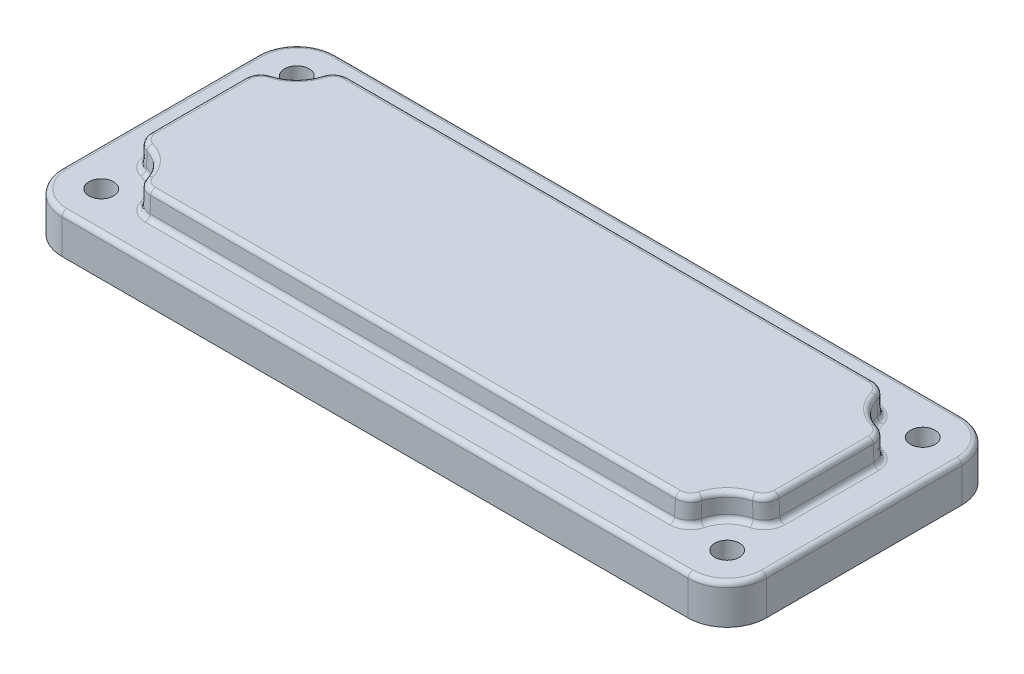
SolidWorks part; units mm, degrees
ref_plane "Front" through (0, 0, 0) normal (0, 0, 1) x (1, 0, 0)
ref_plane "Top" through (0, 0, 0) normal (0, 1, 0) x (1, 0, 0)
ref_plane "Right" through (0, 0, 0) normal (1, 0, 0) x (0, 0, -1)
sketch "Sketch1" plane through (0, 0, 0) normal (0, 1, 0) x (1, 0, 0)
  line L0 (-50.8, 22.225) -> (50.8, 22.225)
  line L1 (-57.15, 15.875) -> (-57.15, -15.875)
  line L2 (50.8, -22.225) -> (-50.8, -22.225)
  line L3 (57.15, -15.875) -> (57.15, 15.875)
  line L4 (-50.8, -15.875) -> (50.8, 15.875) construction
  arc A0 (-57.15, -15.875) -> (-50.8, -22.225) centre (-50.8, -15.875) ccw
  arc A1 (57.15, -15.875) -> (50.8, -22.225) centre (50.8, -15.875) cw
  arc A2 (50.8, 22.225) -> (57.15, 15.875) centre (50.8, 15.875) cw
  arc A3 (-50.8, 22.225) -> (-57.15, 15.875) centre (-50.8, 15.875) ccw
  dimension "D1" = 114.3
  dimension "D2" = 44.45
  dimension "D4" = 6.35
extrude "Base-Extrude" add sketch "Sketch1" along normal blind 6.35
sketch "Sketch2" plane through (0, 6.35, 0) normal (0, 1, 0) x (-1, 0, 0)
  line L4 (50.8, 16.225) -> (-50.8, 16.225)
  line L5 (-51.15, 15.875) -> (-51.15, -15.875)
  line L6 (-50.8, -16.225) -> (50.8, -16.225)
  line L7 (51.15, -15.875) -> (51.15, 15.875)
  line L8 (50.8, 16.225) -> (-50.8, 16.225)
  line L9 (-51.15, 15.875) -> (-51.15, -15.875)
  line L10 (-50.8, -16.225) -> (50.8, -16.225)
  line L11 (51.15, -15.875) -> (51.15, 15.875)
  arc A4 (51.15, 15.875) -> (50.8, 16.225) centre (50.8, 15.875) ccw
  arc A5 (51.15, 15.875) -> (50.8, 16.225) centre (50.8, 15.875) ccw
  arc A6 (-50.8, 16.225) -> (-51.15, 15.875) centre (-50.8, 15.875) ccw
  arc A7 (-50.8, 16.225) -> (-51.15, 15.875) centre (-50.8, 15.875) ccw
  arc A8 (-51.15, -15.875) -> (-50.8, -16.225) centre (-50.8, -15.875) ccw
  arc A9 (-51.15, -15.875) -> (-50.8, -16.225) centre (-50.8, -15.875) ccw
  arc A10 (50.8, -16.225) -> (51.15, -15.875) centre (50.8, -15.875) ccw
  arc A11 (50.8, -16.225) -> (51.15, -15.875) centre (50.8, -15.875) ccw
  dimension "D1" = 6
extrude "Boss-Extrude1" add sketch "Sketch2" along normal blind 4 draft 3
sketch "Sketch3" plane through (0, 10.35, 0) normal (0, 1, 0) x (-1, 0, 0)
  circle A0 centre (-50.8, 15.875) radius 6
  dimension "D1" = 12
extrude "Cut-Extrude1" cut sketch "Sketch3" against normal up to surface (4 mm away)
sketch "Sketch4" plane through (0, 6.35, 0) normal (0, 1, 0) x (-1, 0, 0)
  circle A0 centre (-50.8, 15.875) radius 2
  dimension "D1" = 4
extrude "Cut-Extrude2" cut sketch "Sketch4" against normal through all
mirror "Mirror1" about plane through (0, 0, 0) normal (0, 0, 1) of "Cut-Extrude2", "Cut-Extrude1"
mirror "Mirror2" about plane through (0, 0, 0) normal (1, 0, 0) of "Mirror1", "Cut-Extrude1", "Cut-Extrude2"
fillet "Fillet1" radius 2.54 8 edges at (-51.0452, 8.3493, 9.88) (51.0452, 8.3493, 9.88) (44.805, 8.3493, 16.1202) (51.0452, 8.3493, -9.88) (44.805, 8.3493, -16.1202) (-51.0452, 8.3493, -9.88) (-44.805, 8.3493, -16.1202) (-44.805, 8.3493, 16.1202)
fillet "Fillet2" radius 0.7937 56 edges at (55.2901, 6.35, 20.3651) (0, 6.35, 16.225) (0, 10.35, 16.0154) (-42.5732, 8.3535, 16.12) (42.5732, 8.3535, 16.12) (-50.9404, 10.35, 0) (-46.5574, 10.35, 11.6324) (46.5574, 10.35, 11.6324) (50.9404, 10.35, 0) (46.5574, 10.35, -11.6324) (0, 10.35, -16.0154) (-46.5574, 10.35, -11.6324) (-44.0593, 10.35, 15.5562) (-50.3839, 10.35, 9.2643) (-50.4812, 10.35, -9.1343) (-44.1893, 10.35, -15.4589) (44.0593, 10.35, -15.5562) (50.3839, 10.35, -9.2643) (50.4812, 10.35, 9.1343) (44.1893, 10.35, 15.4589) (46.5574, 6.35, 11.6324) (49.1851, 8.3536, 10.0964) (45.0214, 8.3536, 14.2601) (51.15, 6.35, 0) (51.045, 8.3535, -7.6482) (51.045, 8.3535, 7.6482) (46.5574, 6.35, -11.6324) (45.0214, 8.3536, -14.2601) (49.1851, 8.3536, -10.0964) (57.15, 6.35, 0) (0, 6.35, -16.225) (-42.5732, 8.3535, -16.12) (42.5732, 8.3535, -16.12) (-46.5574, 6.35, -11.6324) (-49.1851, 8.3536, -10.0964) (-45.0214, 8.3536, -14.2601) (-51.15, 6.35, 0) (-51.045, 8.3535, 7.6482) (-51.045, 8.3535, -7.6482) (-46.5574, 6.35, 11.6324) (-45.0214, 8.3536, 14.2601) (-49.1851, 8.3536, 10.0964) (44.4849, 6.35, 15.324) (50.9042, 6.35, 8.7093) (50.2725, 6.35, -9.5398) (43.673, 6.35, -15.9604) (-44.4581, 6.35, -15.3552) (-50.8945, 6.35, -8.7295) (-50.2502, 6.35, 9.5589) (-43.6313, 6.35, 15.9806) (55.2901, 6.35, -20.3651) (0, 6.35, -22.225) (-55.2901, 6.35, -20.3651) (-57.15, 6.35, 0) (-55.2901, 6.35, 20.3651) (0, 6.35, 22.225)
sketch "Sketch5" plane through (0, 0, 0) normal (0, -1, 0) x (1, 0, 0)
  line L0 (-44.45, 15.875) -> (44.45, 15.875)
  line L1 (-44.45, 15.875) -> (-44.45, -15.875)
  line L2 (44.45, -15.875) -> (-44.45, -15.875)
  line L3 (44.45, -15.875) -> (44.45, 15.875)
  line L4 (50.8, 22.225) -> (-50.8, 22.225) construction
  line L5 (57.15, 15.875) -> (57.15, -15.875) construction
  line L6 (-57.15, -15.875) -> (-57.15, 15.875) construction
  line L7 (-50.8, -22.225) -> (50.8, -22.225) construction
  dimension "D1" = 6.35
  dimension "D2" = 12.7
  dimension "D3" = 12.7
  dimension "D4" = 6.35
extrude "Cut-Extrude3" cut sketch "Sketch5" against normal blind 6.35 draft 3
fillet "Fillet3" radius 6.35 4 edges at (-44.2836, 3.175, -15.7086) (-44.2836, 3.175, 15.7086) (44.2836, 3.175, 15.7086) (44.2836, 3.175, -15.7086)
fillet "Fillet4" radius 3.175 8 edges at (-44.1172, 6.35, 0) (0, 6.35, 15.5422) (0, 6.35, -15.5422) (44.1172, 6.35, 0) (-42.2609, 6.35, -13.6859) (42.2609, 6.35, 13.6859) (42.2609, 6.35, -13.6859) (-42.2609, 6.35, 13.6859)
